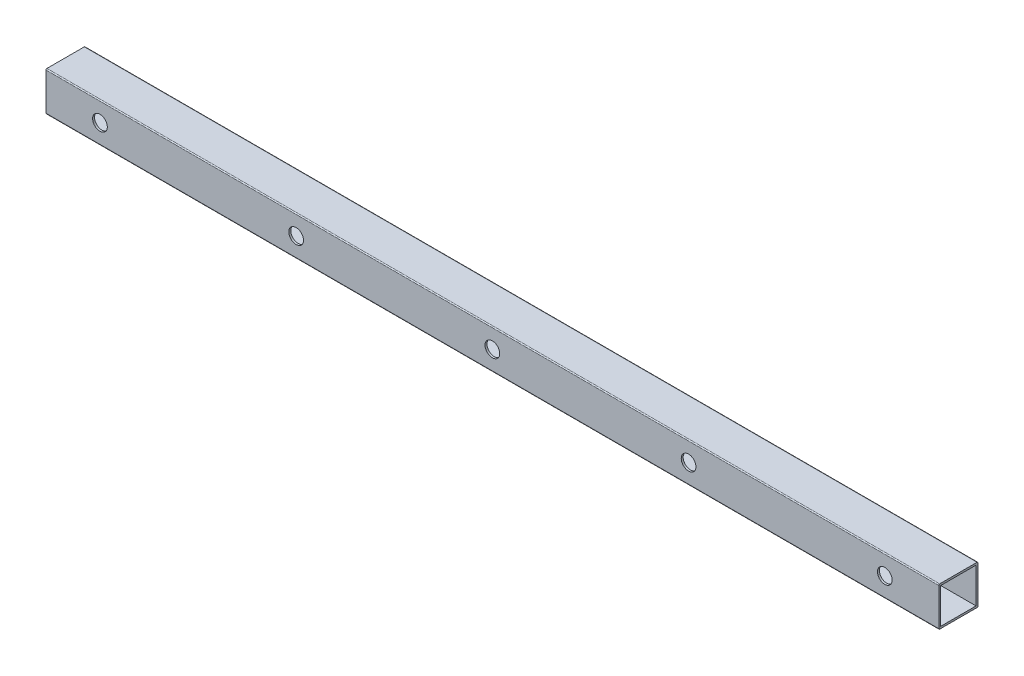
SolidWorks part; units mm, degrees
ref_plane "前视基准面" through (0, 0, 0) normal (0, 0, 1) x (1, 0, 0)
ref_plane "上视基准面" through (0, 0, 0) normal (0, 1, 0) x (1, 0, 0)
ref_plane "右视基准面" through (0, 0, 0) normal (1, 0, 0) x (0, 0, -1)
sketch "草图1" plane through (0, 0, 0) normal (1, 0, 0) x (0, 0, -1)
  line B0 (9, -9) -> (9, 9)
  line B1 (-9.5, -10) -> (9.5, -10)
  line B2 (-10, -9.5) -> (-10, 9.5)
  line B3 (-9.5, 10) -> (9.5, 10)
  line B4 (10, -9.5) -> (10, 9.5)
  line B5 (-9, 9) -> (9, 9)
  line B6 (-9, -9) -> (-9, 9)
  line B7 (-9, -9) -> (9, -9)
  arc B8 (-10, 9.5) -> (-9.5, 10) centre (-9.5, 9.5) cw
  arc B9 (-9.5, -10) -> (-10, -9.5) centre (-9.5, -9.5) cw
  arc B10 (9.5, -10) -> (10, -9.5) centre (9.5, -9.5) ccw
  arc B11 (9.5, 10) -> (10, 9.5) centre (9.5, 9.5) cw
sketch_block_instance "块5-1"
sketch_block "块5" parameters "D3"=0.5, "D1"=20, "D2"=20
extrude "拉伸1" add sketch "草图1" along normal mid plane 455
sketch "草图2" plane through (0, 0, -10) normal (0, 0, -1) x (-1, 0, 0)
  line L0 (-327.5, 0) -> (49672.5, 0) construction
  line L1 (-227.5, -9.5) -> (-227.5, 9.5) construction
  circle A0 centre (-200, 0) radius 3.75
  point P4 (-227.5, 0)
  dimension "D1" = 7.5
  dimension "D2" = 27.5
extrude "拉伸2" cut sketch "草图2" against normal through all
pattern_linear "阵列(线性)1" count 7 spacing 100 along (-1, 0, 0) of "拉伸2"
sketch "草图3" plane through (0, 0, -10) normal (0, 0, -1) x (-1, 0, 0)
  line L0 (-200, 0) -> (0, 0) construction
  circle A1 centre (-175, 0) radius 2.25
  circle A2 centre (-150, 0) radius 2.25
  circle A3 centre (-125, 0) radius 2.25
  dimension "D1" = 4.5
  dimension "D2" = 25
  dimension "D3" = 25
  dimension "D4" = 25
extrude "拉伸3" cut sketch "草图3" against normal blind 1
pattern_linear "阵列(线性)2" count 6 spacing 100 along (-1, 0, 0) of "拉伸3"
